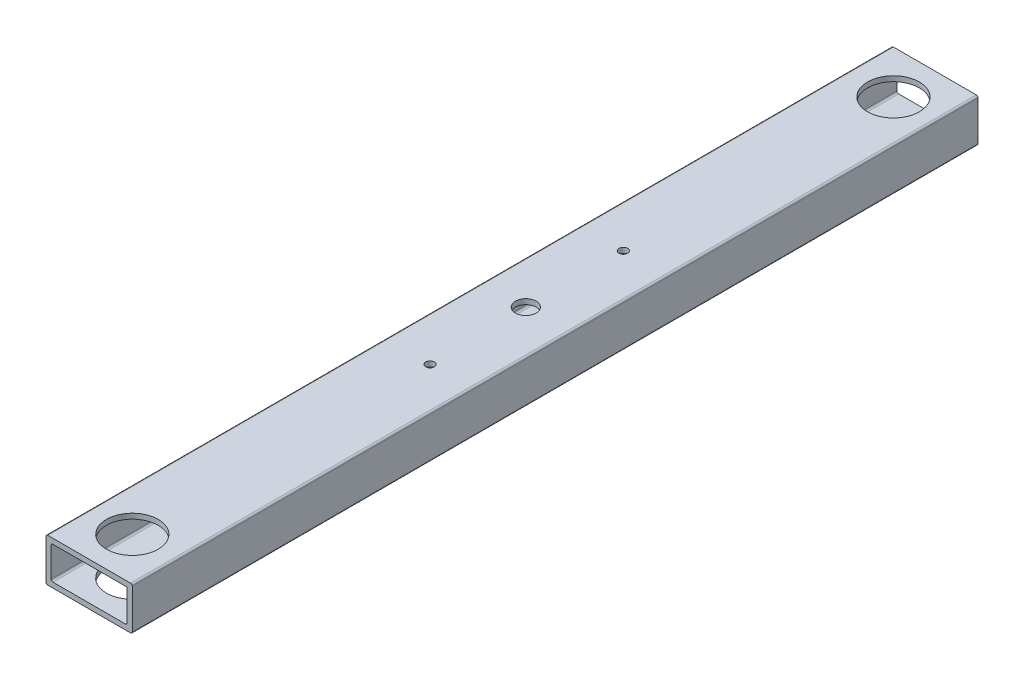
SolidWorks part; units mm, degrees
ref_plane "Plan de face" through (0, 0, 0) normal (0, 0, 1) x (1, 0, 0)
ref_plane "Plan de dessus" through (0, 0, 0) normal (0, 1, 0) x (1, 0, 0)
ref_plane "Plan de droite" through (0, 0, 0) normal (1, 0, 0) x (0, 0, -1)
sketch "Esquisse1" plane through (0, 0, 0) normal (0, 0, 1) x (1, 0, 0)
  line L0 (3, 4) -> (3, 21)
  line L1 (1, 0) -> (49, 0)
  line L2 (0, 1) -> (0, 24)
  line L3 (1, 25) -> (49, 25)
  line L4 (50, 1) -> (50, 24)
  line L5 (4, 22) -> (47, 22)
  line L6 (47, 4) -> (47, 22)
  line L7 (4, 3) -> (46, 3)
  line L8 (3, 3) -> (3, 22) construction
  line L9 (3, 22) -> (47, 22) construction
  line L10 (0, 0) -> (0, 25) construction
  line L11 (0, 25) -> (50, 25) construction
  line L12 (50, 0) -> (50, 25) construction
  line L13 (0, 0) -> (50, 0) construction
  line L14 (47, 3) -> (47, 22) construction
  line L15 (3, 3) -> (47, 3) construction
  arc A0 (3, 21) -> (4, 22) centre (4, 21) cw
  arc A1 (0, 24) -> (1, 25) centre (1, 24) cw
  arc A2 (50, 24) -> (49, 25) centre (49, 24) ccw
  arc A3 (49, 0) -> (50, 1) centre (49, 1) ccw
  arc A4 (47, 4) -> (46, 3) centre (46, 4) cw
  arc A5 (4, 3) -> (3, 4) centre (4, 4) cw
  arc A6 (1, 0) -> (0, 1) centre (1, 1) cw
  dimension "D4" = 1
  dimension "D1" = 50
  dimension "D2" = 25
  dimension "D3" = 3
extrude "Extrusion1" add sketch "Esquisse1" along normal blind 490
sketch "Esquisse2" plane through (0, 25, 0) normal (0, 1, 0) x (-1, 0, 0)
  line L0 (-49, 0) -> (-1, 0) construction
  circle A0 centre (-26, 25) radius 15
  circle A1 centre (-25, 237) radius 6
  circle A2 centre (-25, 465) radius 15
  dimension "D1" = 30
  dimension "D2" = 25
  dimension "D3" = 25
  dimension "D4" = 30
  dimension "D5" = 25
  dimension "D6" = 440
  dimension "D7" = 12
  dimension "D8" = 212
  dimension "D9" = 25
extrude "Enlèv. mat.-Extru.1" cut sketch "Esquisse2" against normal through all
hole_wizard "Trou taraudé M61" positions "Esquisse4" profile "Esquisse3" tap size "M6" standard "ISO"
sketch "Esquisse4" plane through (0, 25, 0) normal (0, 1, 0) x (-1, 0, 0)
  circle A0 centre (-25, 237) radius 6 construction
  point P0 (-25, 180.5)
  point P1 (-26, 293.4956)
  dimension "D1" = 56.5
  dimension "D2" = 113
  dimension "D3" = 25
  dimension "D4" = 25
sketch "Esquisse3" plane through (25, 25, 180.5) normal (1, 0, 0) x (0, 0, 1)
  line L0 (0, 0) -> (0, 16.5022)
  line L1 (0, 16.5022) -> (2.5, 15)
  line L2 (2.5, 15) -> (2.5, 0)
  line L5 (2.5, 0) -> (0, 0)
  line L10 (0, 16.5022) -> (-2.5, 15) construction
  line L11 (0, -6.35) -> (0, 107.95) construction
  dimension "Diamètre du trou pour taraudage" = 5
  dimension "Profondeur du trou pour taraudage" = 15
  dimension "Angle de pointe" = 118
